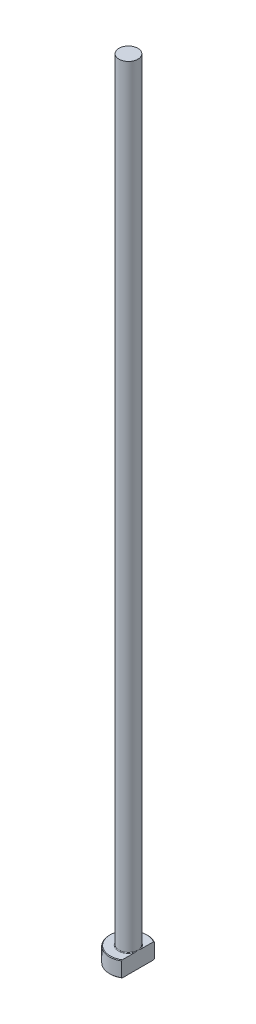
SolidWorks part; units mm, degrees
ref_plane "Front Plane" through (0, 0, 0) normal (0, 0, 1) x (1, 0, 0)
ref_plane "Top Plane" through (0, 0, 0) normal (0, 1, 0) x (1, 0, 0)
ref_plane "Right Plane" through (0, 0, 0) normal (1, 0, 0) x (0, 0, -1)
sketch "Sketch1" plane through (0, 0, 0) normal (0, 0, 1) x (1, 0, 0)
  line L0 (0, 259.9588) -> (0, -15.1925) construction
  line L1 (0, 0) -> (-6, 0)
  line L2 (-6, 0) -> (-6, 5)
  line L3 (-6, 5) -> (-3, 5)
  line L4 (-3, 5) -> (-3, 250)
  line L5 (-3, 250) -> (0, 250)
  line L6 (0, 250) -> (0, 0)
  dimension "L" = 250
  dimension "H" = 12
  dimension "T" = 5
  dimension "D" = 6
revolve "Revolve1" add sketch "Sketch1" angle 360 about L0
chamfer "Chamfer1" distance 0.2 angle 45 2 edges at (0, 5, 6) (0, 0, 6)
fillet "Fillet1" radius 0.2 1 edges at (0, 5, 3)
sketch "Sketch2" plane through (0, 0, 0) normal (0, 1, 0) x (1, 0, 0)
  line L0 (3, 5.1962) -> (3, -5.1962)
  circle A0 centre (0, 0) radius 6 construction
  arc A1 (3, -5.1962) -> (3, 5.1962) centre (0, 0) ccw
  circle A2 centre (0, 0) radius 3 construction
extrude "KEY" cut sketch "Sketch2" along normal through all
